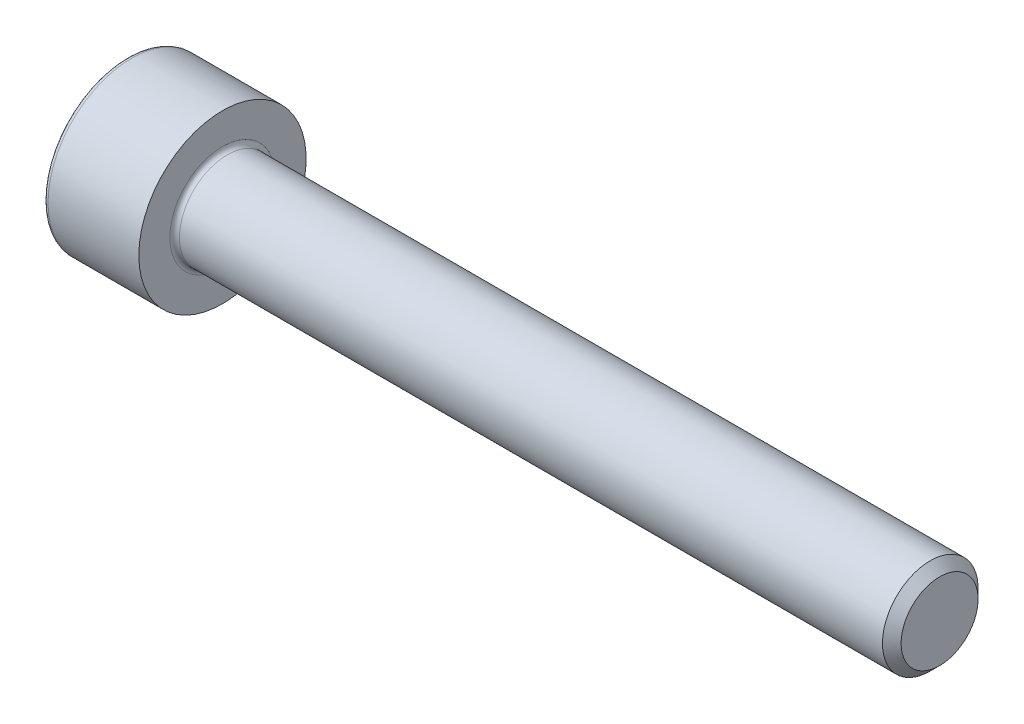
SolidWorks part; units mm, degrees
ref_plane "Plane1" through (0, 0, 0) normal (0, 0, 1) x (1, 0, 0)
ref_plane "Plane2" through (0, 0, 0) normal (0, 1, 0) x (1, 0, 0)
ref_plane "Plane3" through (0, 0, 0) normal (1, 0, 0) x (0, 0, -1)
revolve "Base-Revolve" add sketch "BodySke"
sketch "BodySke" plane through (0, 0, 0) normal (0, 0, 1) x (1, 0, 0)
  line L0 (0, 0) -> (0, 3.5)
  line L1 (0, 3.5) -> (4, 3.5)
  line L2 (4, 3.5) -> (4, 2)
  line L3 (4, 2) -> (33.61, 2)
  line L4 (34, 1.61) -> (34, 0)
  line L5 (34, 0) -> (0, 0)
  line L6 (-31.75, 0) -> (127, 0) construction
  line L8 (34, 1.61) -> (33.61, 2)
  line L10 (34, -1.61) -> (33.61, -2) construction
  line L11 (4.7, 9.525) -> (4.7, 3.175) construction
  line L12 (4, 9.525) -> (4, 3.175) construction
  line L13 (-26, 9.525) -> (-26, 3.175) construction
  dimension "Diameter" = 4
  dimension "Head_ht" = 4
  dimension "Length" = 30
  dimension "Body_ch_ang" = 45
  dimension "Head_dia" = 7
  dimension "Minor_dia" = 3.22
  dimension "Advance" = 0.7
  dimension "Thread_nom" = 30
  dimension "Thread_length" = 60
fillet "Fillet1" radius 0.2 1 edges at (4, 0, 2)
fillet "Fillet2" radius 0.2 1 edges at (0, 0, 3.5)
sketch "Sketch2" plane through (0, 0, 0) normal (0, 0, 1) x (1, 0, 0)
  line L0 (0, 1.5355) -> (2, 1.5355)
  line L1 (2, 1.5355) -> (2.8865, 0)
  line L2 (-31.75, 0) -> (127, 0) construction
  line L3 (2.8865, 0) -> (0, 0)
  line L4 (0, 0) -> (0, 1.5355)
  line L6 (0, 0) -> (47.625, 0) construction
  dimension "D1" = 1.5355
  dimension "D2" = 60
  dimension "Depth" = 2
revolve "Hex-PreBroach" cut sketch "Sketch2" angle 360 about L6
sketch "Sketch3" plane through (0, 0, 0) normal (-1, 0, 0) x (0, 0.5, 0.866)
  line L0 (0.8865, 1.5355) -> (-0.8865, 1.5355)
  line L1 (-0.8865, 1.5355) -> (-1.773, 0)
  line L2 (0.8865, 1.5355) -> (1.773, 0)
  line L3 (0.8865, -1.5355) -> (1.773, 0)
  line L4 (0.8865, -1.5355) -> (-0.8865, -1.5355)
  line L5 (-0.8865, -1.5355) -> (-1.773, 0)
  dimension "D1" = 1.5355
  dimension "D2" = 1.5355
  dimension "Hex_size" = 3.071
extrude "Hex" cut sketch "Sketch3" against normal blind 2
sketch "ThdSchSke" plane through (0, 0, 0) normal (0, 0, 1) x (1, 0, 0)
  line L0 (6.1, -1.61) -> (5.8269, -2)
  line L1 (6.1, -1.61) -> (6.3731, -2)
  line L2 (6.3731, -2) -> (6.3731, -2.5)
  line L3 (-3.175, 0) -> (5.1513, 0) construction
  line L4 (0, 3.3) -> (0, -3.3) construction
  line L5 (6.3731, -2.5) -> (5.8269, -2.5)
  line L6 (5.8269, -2.5) -> (5.8269, -2)
  dimension "Thread_minor" = 3.22
  dimension "Diameter" = 4
  dimension "Start" = 6.1
  dimension "SideAngle" = 55
  dimension "VeeAngle" = 70
  dimension "Overcut" = 5
revolve "ThreadSchematic" [suppressed] cut sketch "ThdSchSke" angle 360 about L3
pattern_linear "ThdSchPat" [suppressed]
equation "\"D2@Sketch3\" = \"Hex_size@Sketch3\" / 2"
equation "\"D1@Sketch3\" = \"Hex_size@Sketch3\" / 2"
equation "\"D1@Sketch2\" = \"Hex_size@Sketch3\" / 2"
equation "\"Thread_minor@ThreadCosmetic\"  =  \"Minor_dia@BodySke\""
equation "\"Depth@Sketch2\" =  \"Key_eng@Hex\""
equation "\"Thread_length@ThreadCosmetic\" = ((sgn( (\"Length@BodySke\" - \"Advance@BodySke\" * 3.0) - \"Thread_nom@BodySke\" )-1)*( (\"Length@BodySke\" - \"Advance@BodySke\" * 3.0) - \"Thread_nom@BodySke\" ))/-2+ \"Thread_no"
equation "\"Thread_minor@ThdSchSke\" = \"Minor_dia@BodySke\""
equation "\"Diameter@ThdSchSke\" = \"Diameter@BodySke\""
equation "\"Overcut@ThdSchSke\" = \"Diameter@BodySke\" * 1.25"
equation "\"Start@ThdSchSke\" = \"Head_ht@BodySke\" + \"Length@BodySke\" - \"Thread_length@ThreadCosmetic\"  '---Non-countersunk---"
equation "\"Num_threads@ThdSchPat\" = int( \"Thread_length@ThreadCosmetic\" / \"Advance@BodySke\" + 0.999 )  + 1"
equation "\"Advance@ThdSchPat\" = \"Thread_length@ThreadCosmetic\" /  (\"Num_threads@ThdSchPat\" - 1) 'relax it"
equation "\"Num_threads@ThdSchPat\" = \"Num_threads@ThdSchPat\" - sgn( \"Num_threads@ThdSchPat\" - 1) '---chamfered tips only---"
